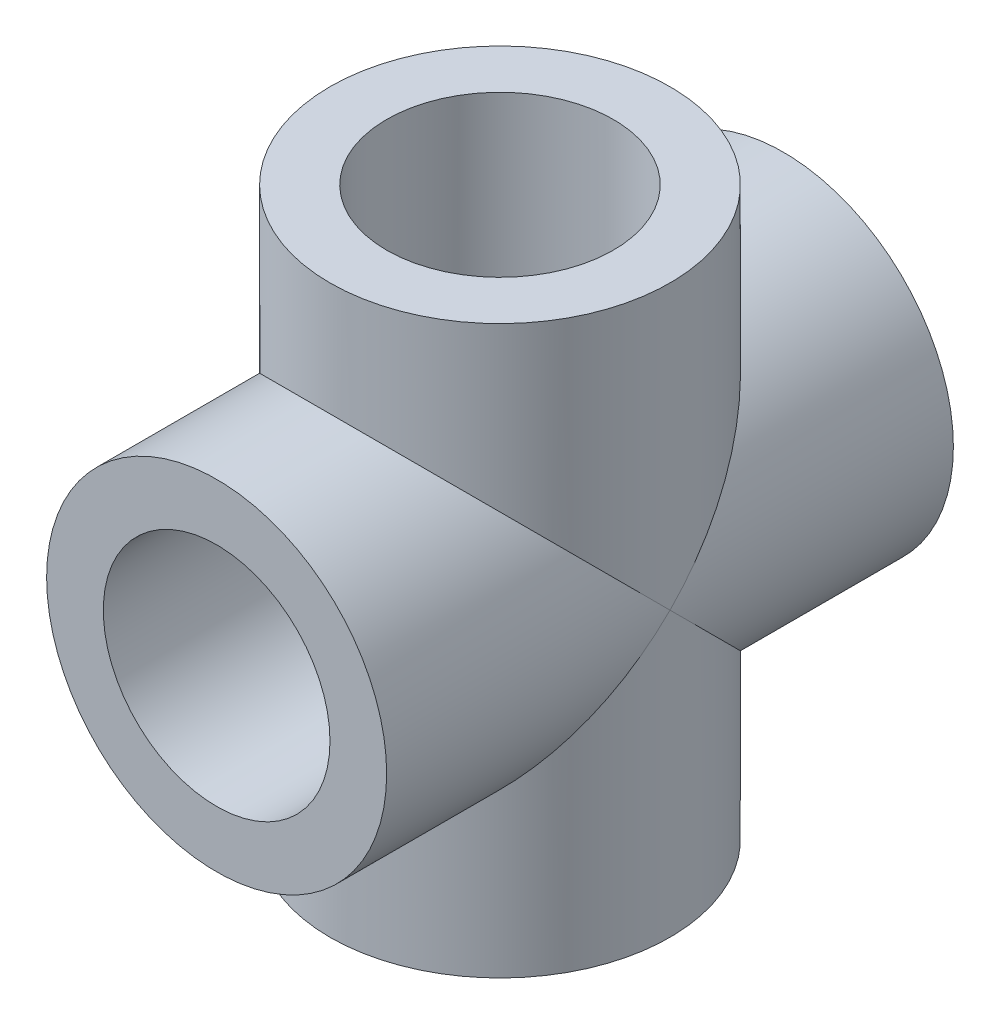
SolidWorks part; units mm, degrees
ref_plane "前视基准面" through (0, 0, 0) normal (0, 0, 1) x (1, 0, 0)
ref_plane "上视基准面" through (0, 0, 0) normal (0, 1, 0) x (1, 0, 0)
ref_plane "右视基准面" through (0, 0, 0) normal (1, 0, 0) x (0, 0, -1)
sketch "草图1" plane through (0, 0, 0) normal (0, 1, 0) x (1, 0, 0)
  circle A0 centre (0, 0) radius 6
  dimension "D1" = 12
extrude "凸台-拉伸1" add sketch "草图1" along normal blind 20
sketch "草图2" plane through (0, 0, 0) normal (0, 0, 1) x (1, 0, 0)
  line L0 (0, 18.9447) -> (0, 2.2457) construction
  line L1 (-5.0593, 10) -> (4.7286, 10) construction
  circle A0 centre (0, 10) radius 6
  dimension "D1" = 12
extrude "凸台-拉伸2" add sketch "草图2" along normal mid plane 20
sketch "草图3" plane through (0, 0, 0) normal (0, 0, 1) x (1, 0, 0)
  circle A0 centre (0, 10) radius 4
  dimension "D1" = 8
extrude "切除-拉伸1" cut sketch "草图3" against normal mid plane 20
sketch "草图4" plane through (0, 0, 0) normal (0, 1, 0) x (1, 0, 0)
  circle A0 centre (0, 0) radius 4
  dimension "D1" = 8
extrude "切除-拉伸2" cut sketch "草图4" against normal mid plane 40
